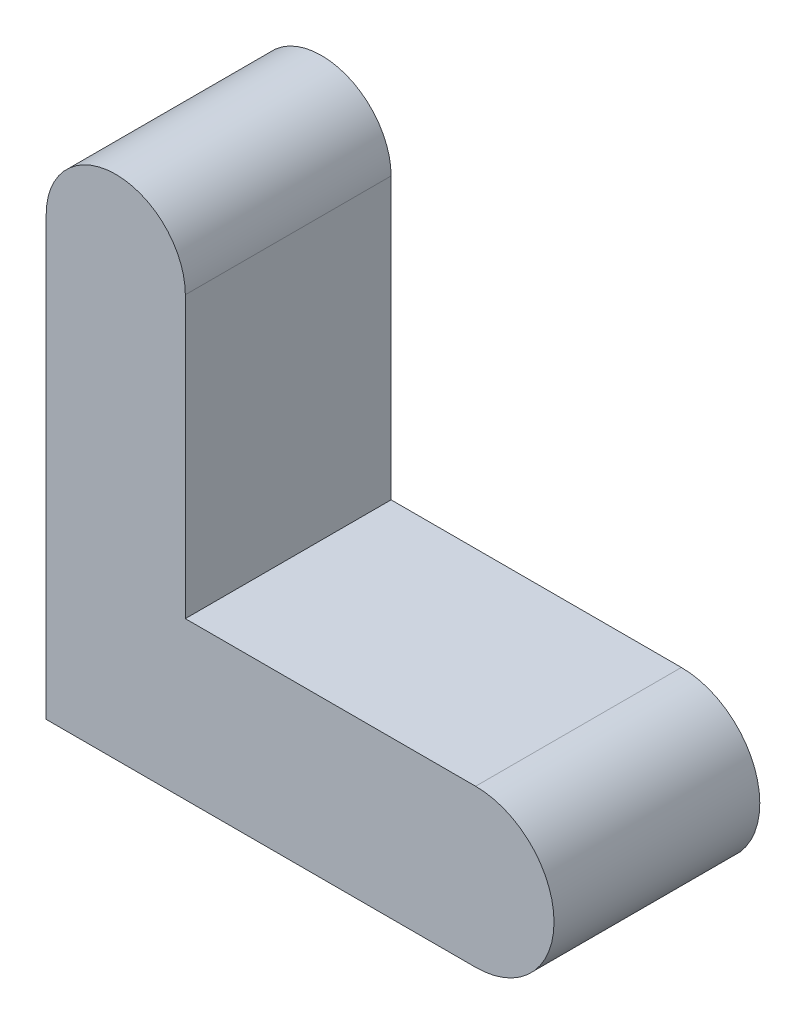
SolidWorks part; units mm, degrees
ref_plane "FrontPlane" through (0, 0, 0) normal (0, 0, 1) x (1, 0, 0)
ref_plane "Top" through (0, 0, 0) normal (0, 1, 0) x (1, 0, 0)
ref_plane "Right" through (0, 0, 0) normal (1, 0, 0) x (0, 0, -1)
ref_plane "Plane1" through (0, 0, 75.1895) normal (0, 0, 1) x (1, 0, 0)
sketch "Sketch1" plane through (0, 0, 0) normal (0, 0, 1) x (1, 0, 0)
  line L0 (-61.3036, -19.4349) -> (45.1263, -19.4349)
  line L1 (45.1263, 19.4349) -> (-26.8203, 19.4349)
  line L2 (-26.8203, 19.4349) -> (-26.8203, 88.9544)
  line L3 (-61.3036, 88.9544) -> (-61.3036, -19.4349)
  arc A0 (45.1263, -19.4349) -> (45.1263, 19.4349) centre (45.1263, 0) ccw
  arc A1 (-26.8203, 88.9544) -> (-61.3036, 88.9544) centre (-44.062, 88.9544) ccw
extrude "Extrude1" add sketch "Sketch1" along normal blind 51 from offset 30
